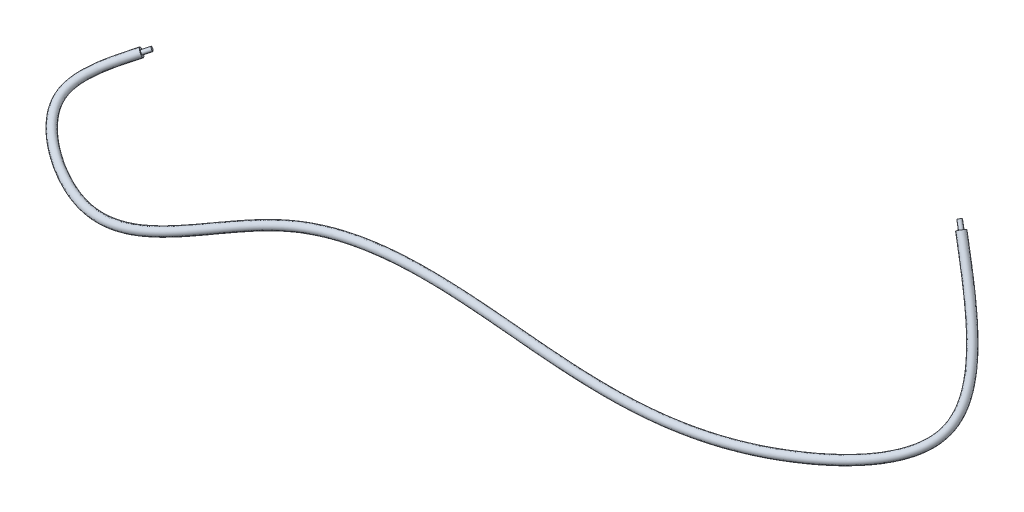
SolidWorks part; units mm, degrees
ref_plane "Plan de face" through (0, 0, 0) normal (0, 0, 1) x (1, 0, 0)
ref_plane "Plan de dessus" through (0, 0, 0) normal (0, 1, 0) x (1, 0, 0)
ref_plane "Plan de droite" through (0, 0, 0) normal (1, 0, 0) x (0, 0, -1)
sketch3d "Esquisse3D1"
  spline S0 degree 3 poles (-20.8432, -16.8414, -16.8733) (-22.9953, -18.09, -14.8703) (-27.6726, -20.8038, -10.5171) (-12.0457, -28.0607, -0.8026) (7.3605, -11.9843, -9.354) (35.8283, -17.2409, -9.1796) (57.6706, -19.0524, -11.4515) (77.7752, -14.2452, -23.2574) (70.8171, -4.1923, -27.6544) (66.9244, 1.4319, -30.1143) knots 0 0 0 0 0.062133 0.135041 0.334206 0.563492 0.75901 0.865178 1 1 1 1
ref_plane "Plan1" through (66.9244, 1.4319, -30.1143) normal (-0.5355, 0.7737, -0.3384) x (-0.8445, -0.4907, 0.2146)
sketch "Esquisse1" plane through (66.9244, 1.4319, -30.1143) normal (-0.5355, 0.7737, -0.3384) x (-0.8445, -0.4907, 0.2146)
  circle A0 centre (0, 0) radius 0.5
  dimension "D1" = 1
sweep "Balayage1" add profiles "Esquisse1" path "Esquisse3D1"
sketch "Esquisse2" plane through (13.1428, -18.9886, 8.3053) normal (-0.5355, 0.7737, -0.3384) x (-0.8445, -0.4907, 0.2146)
  circle A2 centre (-63.6837, -27.0168) radius 0.25
  circle A3 centre (-63.6837, -27.0168) radius 0.25
  dimension "D1" = 0.25
extrude "Extrusion1" add sketch "Esquisse2" along normal blind 1
sketch "Esquisse3" plane through (-6.7688, -3.9272, 6.2997) normal (0.6738, 0.3909, -0.6271) x (-0.5424, -0.3147, -0.779)
  circle A2 centre (29.7487, -4.1071) radius 0.25
  circle A3 centre (29.7487, -4.1071) radius 0.25
  dimension "D1" = 0.25
extrude "Extrusion2" add sketch "Esquisse3" along normal blind 1
